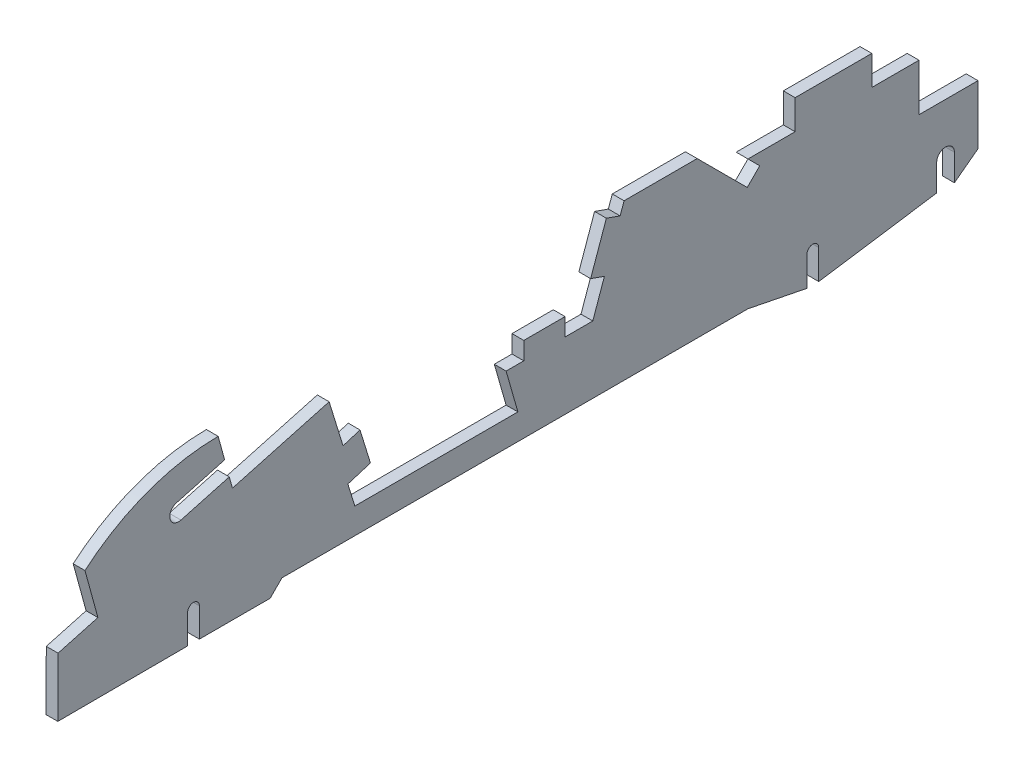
SolidWorks part; units mm, degrees
ref_plane "Plano frontal" through (0, 0, 0) normal (0, 0, 1) x (1, 0, 0)
ref_plane "Plano superior" through (0, 0, 0) normal (0, 1, 0) x (1, 0, 0)
ref_plane "Plano direito" through (0, 0, 0) normal (1, 0, 0) x (0, 0, -1)
sketch "Esboço1" plane through (0, 0, 0) normal (1, 0, 0) x (0, 0, -1)
  line L0 (0, 0) -> (-10, 0)
  line L1 (-10, 0) -> (-10, 8)
  line L2 (-10, 8) -> (-18, 8)
  line L3 (-18, 8) -> (-18, 13)
  line L4 (-18, 13) -> (-31, 13)
  line L5 (-31, 13) -> (-31, 8)
  line L6 (-31, 8) -> (-39, 8)
  line L7 (-39, 8) -> (-37, 6)
  line L8 (-37, 6) -> (-39.1213, 3.8787)
  line L9 (-39.1213, 3.8787) -> (-47.6066, 12.364)
  line L10 (-47.6066, 12.364) -> (-60, 12.364)
  line L11 (-60, 12.364) -> (-60.6667, 10.4783)
  line L12 (-60.6667, 10.4783) -> (-63, 11.3033)
  line L13 (-63, 11.3033) -> (-65.6667, 3.7608)
  line L14 (-65.6667, 3.7608) -> (-63.3333, 2.9359)
  line L15 (-63.3333, 2.9359) -> (-65.3033, -2.636)
  line L16 (-65.3033, -2.636) -> (-70, -2.636)
  line L17 (-70, -2.636) -> (-70, 0.364)
  line L18 (-70, 0.364) -> (-77, 0.364)
  line L19 (-77, 0.364) -> (-77, -2.636)
  line L20 (-77, -2.636) -> (-80, -2.636)
  line L21 (-80, -2.636) -> (-78, -9.636)
  line L22 (-78, -9.636) -> (-105.6458, -9.636)
  line L23 (-105.6458, -9.636) -> (-106.8229, -5.8132)
  line L24 (-106.8229, -5.8132) -> (-103, -4.636)
  line L25 (-103, -4.636) -> (-104.7657, 1.0983)
  line L26 (-104.7657, 1.0983) -> (-107.6458, 0.2115)
  line L27 (-107.6458, 0.2115) -> (-110, 7.8572)
  line L28 (-110, 7.8572) -> (-126.3954, 3.364)
  line L29 (-126.3954, 3.364) -> (-126.9241, 5.2928)
  line L30 (-126.9241, 5.2928) -> (-135.1218, 3.0462)
  line L31 (-135.9147, 5.9395) -> (-127.717, 8.1862)
  line L32 (-127.717, 8.1862) -> (-128.8132, 12.1862)
  line L33 (-151.3921, 3.7716) -> (-149.1997, -4.2284)
  line L34 (-149.1997, -4.2284) -> (-155.9508, -6.0785)
  line L35 (-155.9508, -6.0785) -> (-156, -16.0785)
  line L36 (-156, -16.0785) -> (-134, -16)
  line L37 (-134, -16) -> (-134, -11.101)
  line L38 (-132, -11.101) -> (-132, -16)
  line L39 (-132, -16) -> (-120, -16)
  line L40 (-120, -16) -> (-118, -14)
  line L41 (-118, -14) -> (-39, -14)
  line L43 (-39, -14) -> (-29, -16)
  line L44 (-29, -16) -> (-29, -11)
  line L45 (-27, -11) -> (-27, -16)
  line L46 (-27, -16) -> (-7, -13)
  line L47 (-7, -13) -> (-7, -8.5)
  line L48 (-4, -8.5) -> (-4, -13)
  line L49 (-4, -13) -> (0, -10)
  line L50 (0, -10) -> (0, 0)
  line L51 (0, 0) -> (0.7789, -1.0264)
  arc A0 (-135.1218, 3.0462) -> (-135.9147, 5.9395) centre (-135.5183, 4.4929) cw
  arc A1 (-151.3921, 3.7716) -> (-128.8132, 12.1862) centre (-128.6273, -22.8134) cw
  arc A2 (-134, -11.101) -> (-132, -11.101) centre (-133, -11.101) cw
  arc A3 (-29, -11) -> (-27, -11) centre (-28, -11) cw
  arc A4 (-7, -8.5) -> (-4, -8.5) centre (-5.5, -8.5) cw
  dimension "D38" = 24
  dimension "D39" = 35
  dimension "D1" = 10
  dimension "D2" = 8
  dimension "D3" = 8
  dimension "D4" = 13
  dimension "D5" = 13
  dimension "D6" = 8
  dimension "D7" = 2
  dimension "D8" = 2
  dimension "D9" = 3
  dimension "D10" = 12
  dimension "D11" = 60
  dimension "D12" = 2
  dimension "D13" = 8
  dimension "D14" = 15
  dimension "D15" = 5
  dimension "D16" = 3
  dimension "D17" = 70
  dimension "D18" = 3
  dimension "D19" = 7
  dimension "D20" = 3
  dimension "D21" = 3
  dimension "D22" = 10
  dimension "D23" = 2
  dimension "D24" = 103
  dimension "D25" = 4
  dimension "D26" = 4
  dimension "D27" = 5
  dimension "D28" = 6
  dimension "D29" = 8
  dimension "D30" = 110
  dimension "D31" = 17
  dimension "D32" = 13
  dimension "D33" = 2
  dimension "D34" = 10
  dimension "D35" = 3
  dimension "D36" = 4
  dimension "D37" = 5
  dimension "D40" = 8
  dimension "D41" = 7
  dimension "D42" = 10
  dimension "D43" = 134
  dimension "D44" = 156
  dimension "D45" = 10
  dimension "D46" = 4
  dimension "D47" = 6
  dimension "D48" = 3
  dimension "D49" = 27
  dimension "D50" = 2
  dimension "D51" = 6
  dimension "D52" = 16
  dimension "D53" = 13
  dimension "D54" = 10
  dimension "D55" = 14
  dimension "D56" = 2
  dimension "D57" = 6
  dimension "D58" = 12
  dimension "D59" = 14
  dimension "D60" = 2
extrude "Ressalto-extrusão1" add sketch "Esboço1" along normal blind 2 contours L47 A4 L48 L49 L50 L0 L1 L2 L3 L4 L5 L6 L7 L8 L9 L10 L11 L12 L13 L14 L15 L16 L17 L18 L19 L20 L21 L22 L23 L24 L25 L26 L27 L28 L29 L30 A0 L31 L32 A1 L33 L34 L35 L36 L37 A2 L38 L39 L40 L41 L43
